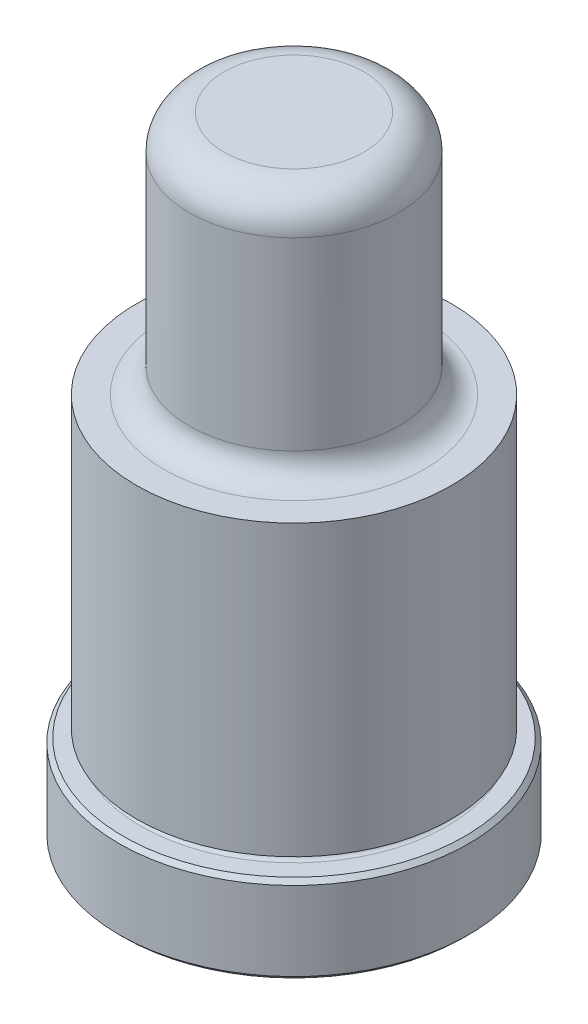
SolidWorks part; units mm, degrees
ref_plane "Front Plane" through (0, 0, 0) normal (0, 0, 1) x (1, 0, 0)
ref_plane "Top Plane" through (0, 0, 0) normal (0, 1, 0) x (1, 0, 0)
ref_plane "Right Plane" through (0, 0, 0) normal (1, 0, 0) x (0, 0, -1)
sketch "Sketch1" plane through (0, 0, 0) normal (1, 0, 0) x (0, 0, -1)
  line L0 (0, 0) -> (15.875, 0)
  line L1 (15.875, 0) -> (15.875, 7.9248)
  line L2 (15.875, 7.9248) -> (13.8938, 7.9248)
  line L3 (13.5128, 2.6782) -> (13.5128, 5.9795) construction
  line L4 (13.8938, 8.6868) -> (14.3002, 8.6868)
  line L5 (14.3002, 8.6868) -> (14.3002, 34.925)
  line L6 (14.3002, 34.925) -> (11.7983, 34.925)
  line L7 (9.5123, 37.211) -> (9.5123, 57.15)
  line L9 (9.5123, 57.15) -> (0, 57.15)
  line L10 (0, 57.15) -> (0, 0)
  line L11 (0, 0) -> (0, -7.2694) construction
  arc A0 (13.8938, 8.6868) -> (13.8938, 7.9248) centre (13.8938, 8.3058) ccw
  arc A1 (11.7983, 34.925) -> (9.5123, 37.211) centre (11.7983, 37.211) cw
  point P2 (9.5123, 57.15)
  point P14 (9.5123, 56.973)
  point P19 (9.5123, 34.925)
  dimension "D14" = 0.762
  dimension "D8" = 2.286
  dimension "T" = 7.9248
  dimension "D2" = 0.762
  dimension "M" = 31.75
  dimension "B" = 28.6004
  dimension "L" = 57.15
  dimension "D7" = 0.7874
  dimension "A" = 34.925
  dimension "D" = 19.0246
  dimension "D15" = 22.225
revolve "Revolve1" add sketch "Sketch1" angle 360 about L11
chamfer "Chamfer1" distance 0.381 angle 45 2 edges at (0, 0, 15.875) (0, 7.9248, 15.875)
fillet "Fillet1" radius 3.175 1 edges at (0, 57.15, 9.5123)
